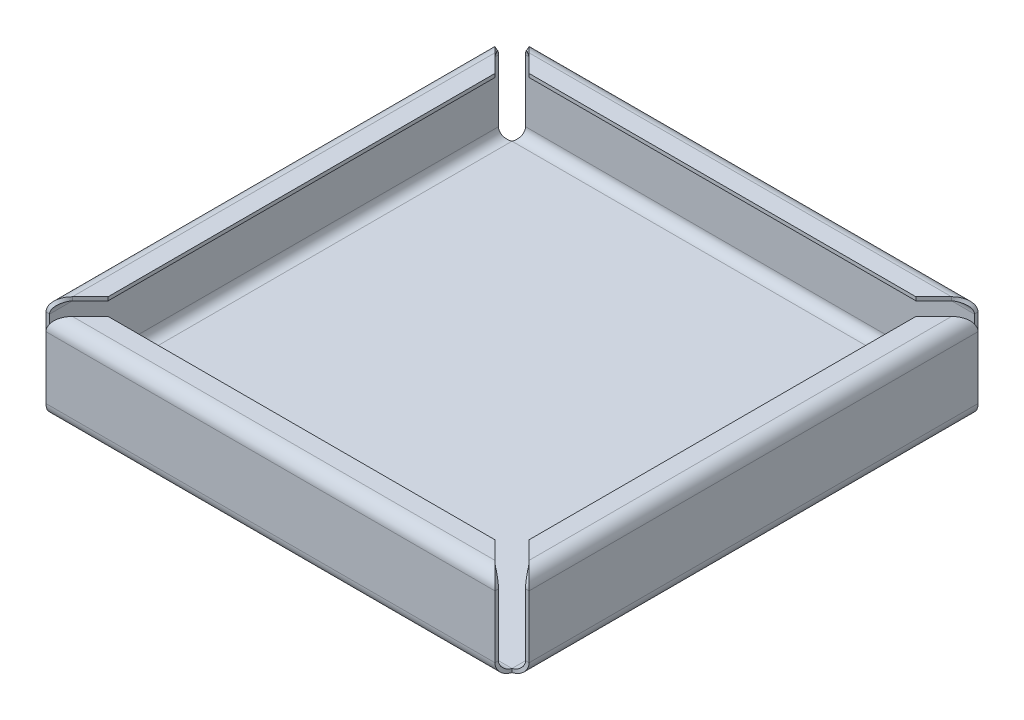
SolidWorks part; units mm, degrees
ref_plane "Front" through (0, 0, 0) normal (0, 0, 1) x (1, 0, 0)
ref_plane "Top" through (0, 0, 0) normal (0, 1, 0) x (1, 0, 0)
ref_plane "Right" through (0, 0, 0) normal (1, 0, 0) x (0, 0, -1)
sketch "Sketch1" plane through (0, 0, 0) normal (0, 1, 0) x (1, 0, 0)
  line L0 (50, -50) -> (-50, 50) construction
  line L1 (-50, 50) -> (50, 50)
  line L2 (-50, 50) -> (-50, -50)
  line L3 (-50, -50) -> (50, -50)
  line L4 (50, 50) -> (50, -50)
  dimension "D1" = 100
  dimension "D2" = 100
sheet metal parameters "Sheet-Metal1" thickness 0.7366 parameters "D1"=2
base flange "Base-Flange1" sketch "Sketch1" thickness 0.7366 reverse thickness direction yes parameters "D1"=2
sketch "Sketch3" plane through (0, 0, 50) normal (0, 0, 1) x (1, 0, 0)
  line L0 (50, 0.7366) -> (50, 18.3521)
  line L1 (50, 18.3521) -> (43.5708, 18.3521)
miter flange "Miter Flange5" parameters "D1"=2
bend "Miterbend51" bend radius 2 bend angle 90 parameters "D5"=3
bend "Miterbend52" bend radius 2 bend angle 90 parameters "D5"=5
bend "Miterbend53" bend radius 2 bend angle 90 parameters "D5"=8
bend "Miterbend54" bend radius 2 bend angle 90 parameters "D5"=9
bend "Miterbend55" bend radius 2 bend angle 90 parameters "D5"=10
bend "Miterbend56" bend radius 2 bend angle 90 parameters "D5"=11
bend "Miterbend57" bend radius 2 bend angle 90 parameters "D5"=12
bend "Miterbend58" bend radius 2 bend angle 90 parameters "D5"=13
flat pattern "Flat-Pattern1"
sketch "Bend-Lines1" plane through (0, 0.7366, 0) normal (0, 1, 0) x (-1, 0, 0)
  line L0 (48.2322, 49.1235) -> (-48.2322, 49.1235) construction
  line L1 (46.8639, 65.7224) -> (-46.8639, 65.7224) construction
  line L2 (49.1235, -48.2322) -> (49.1235, 48.2322) construction
  line L3 (65.7224, -46.8639) -> (65.7224, 46.8639) construction
  line L4 (-48.2322, -49.1235) -> (48.2322, -49.1235) construction
  line L5 (-46.8639, -65.7224) -> (46.8639, -65.7224) construction
  line L6 (-65.7224, 46.8639) -> (-65.7224, -46.8639) construction
  line L7 (-49.1235, 48.2322) -> (-49.1235, -48.2322) construction
bend of the flat pattern "Flatten-<Miterbend51>1"
bend of the flat pattern "Flatten-<Miterbend52>1"
bend of the flat pattern "Flatten-<Miterbend53>1"
bend of the flat pattern "Flatten-<Miterbend54>1"
bend of the flat pattern "Flatten-<Miterbend55>1"
bend of the flat pattern "Flatten-<Miterbend56>1"
bend of the flat pattern "Flatten-<Miterbend57>1"
bend of the flat pattern "Flatten-<Miterbend58>1"
